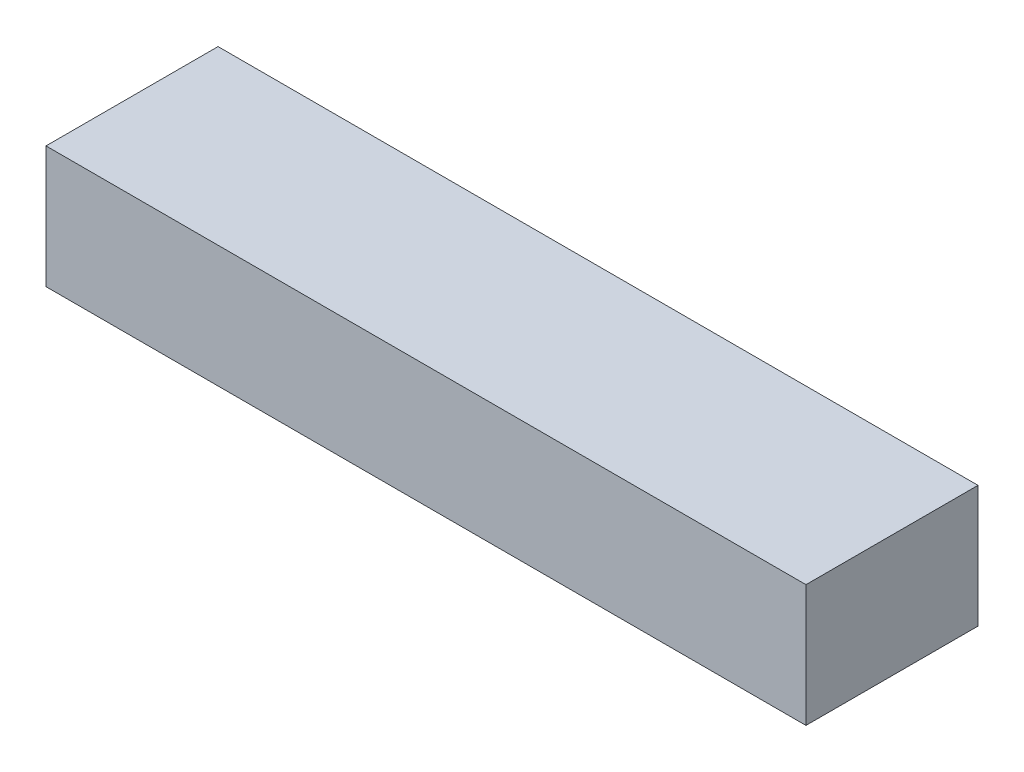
SolidWorks part; units mm, degrees
ref_plane "Front Plane" through (0, 0, 0) normal (0, 0, 1) x (1, 0, 0)
ref_plane "Top Plane" through (0, 0, 0) normal (0, 1, 0) x (1, 0, 0)
ref_plane "Right Plane" through (0, 0, 0) normal (1, 0, 0) x (0, 0, -1)
sketch "Sketch1" plane through (0, 0, 0) normal (0, 0, 1) x (1, 0, 0)
  line L1 (0, 0) -> (28.05, 0)
  line L2 (0, 0) -> (0, 4.5)
  line L3 (0, 4.5) -> (28.05, 4.5)
  line L4 (28.05, 0) -> (28.05, 4.5)
  dimension "D1" = 4.5
  dimension "D2" = 28.05
extrude "Boss-Extrude1" add sketch "Sketch1" along normal blind 6.35
